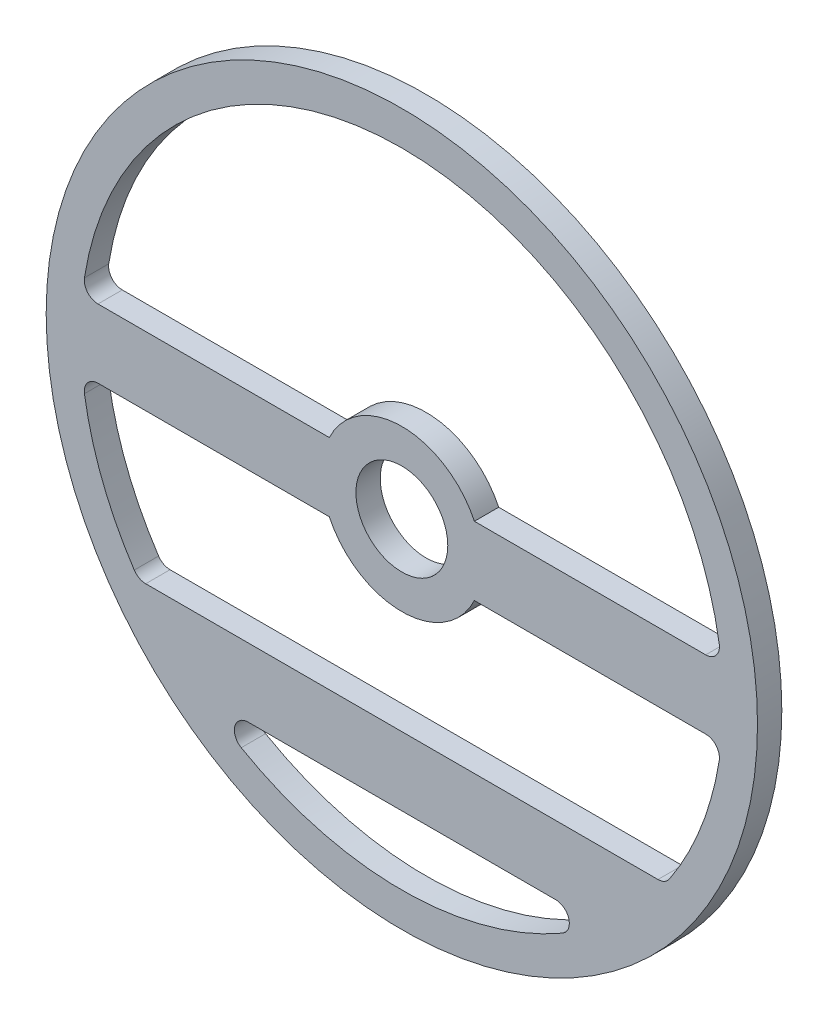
SolidWorks part; units mm, degrees
ref_plane "Front Plane" through (0, 0, 0) normal (0, 0, 1) x (1, 0, 0)
ref_plane "Top Plane" through (0, 0, 0) normal (0, 1, 0) x (1, 0, 0)
ref_plane "Right Plane" through (0, 0, 0) normal (1, 0, 0) x (0, 0, -1)
sketch "Sketch1" plane through (0, 0, 0) normal (0, 0, 1) x (1, 0, 0)
  line L0 (59.1334, -6.35) -> (13.4239, -6.35)
  line L1 (59.1334, 6.35) -> (13.4239, 6.35)
  line L2 (0, 59.4734) -> (0, -59.4734) construction
  line L3 (-59.1334, -6.35) -> (-13.4239, -6.35)
  line L4 (-59.1334, 6.35) -> (-13.4239, 6.35)
  line L5 (-36.7333, -46.7734) -> (36.7333, -46.7734)
  line L6 (-48.7451, -34.0734) -> (48.7451, -34.0734)
  circle A0 centre (0, 0) radius 65.8234
  circle A1 centre (0, 0) radius 8.5
  circle A2 centre (0, 0) radius 14.85
  circle A3 centre (0, 0) radius 59.4734
  dimension "D1" = 6.35
  dimension "D2" = 17
  dimension "D3" = 6.35
  dimension "D4" = 12.7
  dimension "D5" = 12.7
  dimension "D6" = 0
  dimension "D7" = 12.7
extrude "Boss-Extrude2" add sketch "Sketch1" along normal blind 4.5 contours L4 A3 L3 A2 | L2 A2 A1 | A2 L2 A1 | L0 A3 L1 A2 | A0 A3 | L6 L2 L5 A3 | L2 L6 A3 L5
fillet "Fillet1" radius 2.54 8 edges at (36.7333, -46.7734, 2.25) (-36.7333, -46.7734, 2.25) (59.1334, 6.35, 2.25) (59.1334, -6.35, 2.25) (-48.7451, -34.0734, 2.25) (48.7451, -34.0734, 2.25) (-59.1334, -6.35, 2.25) (-59.1334, 6.35, 2.25)
